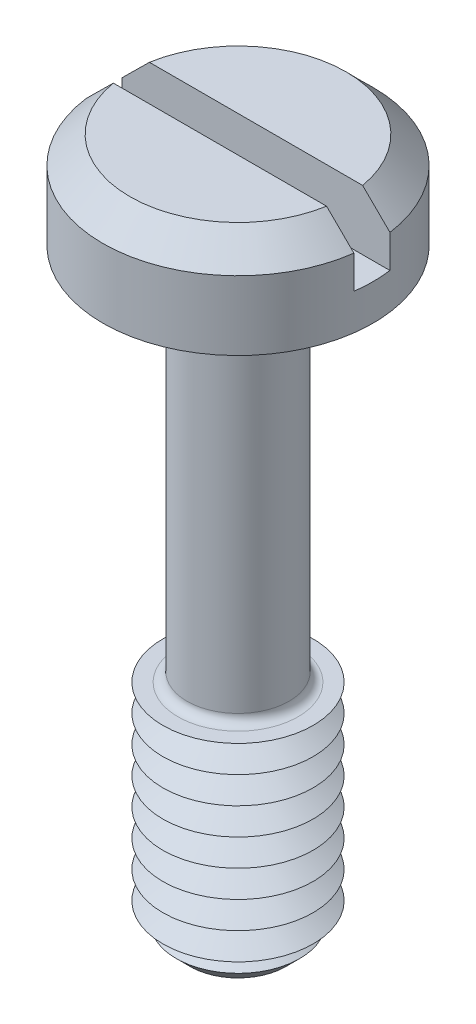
SolidWorks part; units mm, degrees
ref_plane "Front Plane" through (0, 0, 0) normal (0, 0, 1) x (1, 0, 0)
ref_plane "Top Plane" through (0, 0, 0) normal (0, 1, 0) x (1, 0, 0)
ref_plane "Right Plane" through (0, 0, 0) normal (1, 0, 0) x (0, 0, -1)
sketch "Sketch1" plane through (0, 0, 0) normal (0, 1, 0) x (1, 0, 0)
  circle A0 centre (0, 0) radius 2.25
  dimension "D1" = 4.5
extrude "Boss-Extrude1" add sketch "Sketch1" along normal blind 1.6
sketch "Sketch2" plane through (0, 0, 0) normal (0, -1, 0) x (1, 0, 0)
  circle A0 centre (0, 0) radius 0.85
  dimension "D1" = 1.7
extrude "Boss-Extrude2" add sketch "Sketch2" along normal blind 10
sketch "Sketch3" plane through (0, -10, 0) normal (0, -1, 0) x (1, 0, 0)
  circle A0 centre (0, 0) radius 1.25
  dimension "D1" = 2.5
extrude "Boss-Extrude3" add sketch "Sketch3" against normal blind 3.7
chamfer "Chamfer1" distance 0.45 angle 45 1 edges at (0, -10, -1.25)
sketch "Sketch4" plane through (0, 0, 0) normal (1, 0, 0) x (0, 0, -1)
  line L0 (0, -6.5871) -> (0, -12.0372) construction
sketch "Sketch5" plane through (0, 0, 0) normal (1, 0, 0) x (0, 0, -1)
  line L0 (-1.25, -6.3) -> (-0.8603, -6.525)
  line L1 (-0.8603, -6.525) -> (-1.25, -6.75)
  line L2 (-1.25, -6.3) -> (-1.25, -9.55) construction
  line L3 (-1.25, -6.75) -> (-1.25, -6.3)
  dimension "D1" = 0.45
revolve "Cut-Revolve1" cut sketch "Sketch5" angle 360 about L0
pattern_linear "LPattern1" count 8 spacing 0.45 along (0, -1, 0) of "Cut-Revolve1"
fillet "Fillet1" radius 0.15 2 edges at (0, -6.3, -0.85) (0, 0, -0.85)
chamfer "Chamfer2" distance 0.45 angle 45 1 edges at (0, 1.6, 2.25)
sketch "Sketch6" plane through (0, 1.6, 0) normal (0, 1, 0) x (1, 0, 0)
  line L1 (2.25, -0.3) -> (-2.25, -0.3)
  line L2 (2.25, -0.3) -> (2.25, 0.3)
  line L3 (2.25, 0.3) -> (-2.25, 0.3)
  line L4 (-2.25, -0.3) -> (-2.25, 0.3)
  line L5 (2.25, -0.3) -> (-2.25, 0.3) construction
  line L6 (2.25, 0.3) -> (-2.25, -0.3) construction
  circle A0 centre (0, 0) radius 2.25 construction
  point P0 (0, 0)
  dimension "D1" = 0.6
extrude "Cut-Extrude1" cut sketch "Sketch6" against normal blind 1
